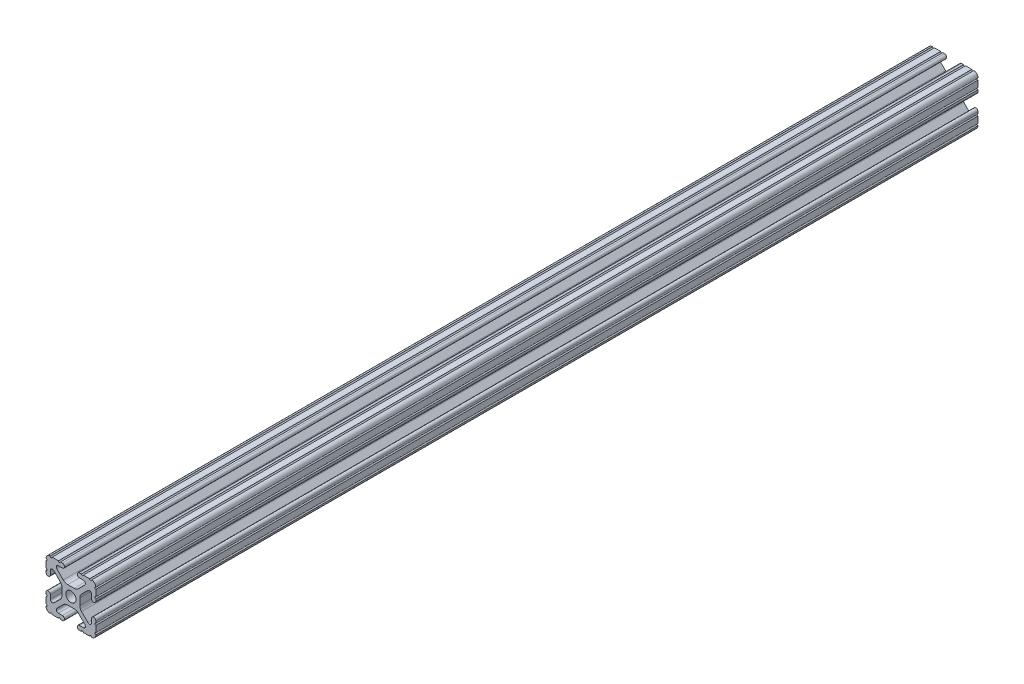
SolidWorks part; units mm, degrees
ref_plane "Front Plane" through (0, 0, 0) normal (0, 0, 1) x (1, 0, 0)
ref_plane "Top Plane" through (0, 0, 0) normal (0, 1, 0) x (1, 0, 0)
ref_plane "Right Plane" through (0, 0, 0) normal (1, 0, 0) x (0, 0, -1)
sketch "Sketch1" plane through (0, 0, 0) normal (0, 0, 1) x (1, 0, 0)
  line L0 (10.5918, 12.7) -> (10.5664, 12.7)
  line L1 (9.5504, 12.7) -> (6.3246, 12.7)
  line L2 (5.3086, 12.7) -> (4.3561, 12.7)
  line L3 (4.3561, 10.4902) -> (6.3701, 10.4902)
  line L4 (7.1192, 8.6817) -> (3.8846, 5.4471)
  line L5 (1.6396, 4.5172) -> (-1.6396, 4.5172)
  line L6 (-3.8846, 5.4471) -> (-7.1192, 8.6817)
  line L7 (-6.3701, 10.4902) -> (-4.3561, 10.4902)
  line L8 (-4.3561, 12.7) -> (-5.3086, 12.7)
  line L9 (-6.3246, 12.7) -> (-9.5504, 12.7)
  line L10 (-10.5664, 12.7) -> (-10.5918, 12.7)
  line L11 (-12.7, 10.5918) -> (-12.7, 10.5664)
  line L12 (-12.7, 9.5504) -> (-12.7, 6.3246)
  line L13 (-12.7, 5.3086) -> (-12.7, 4.3561)
  line L14 (-10.4902, 4.3561) -> (-10.4902, 6.3701)
  line L15 (-8.6817, 7.1192) -> (-5.4471, 3.8846)
  line L16 (-4.5172, 1.6396) -> (-4.5172, -1.6396)
  line L17 (-5.4471, -3.8846) -> (-8.6817, -7.1192)
  line L18 (-10.4902, -6.3701) -> (-10.4902, -4.3561)
  line L19 (-12.7, -4.3561) -> (-12.7, -5.3086)
  line L20 (-12.7, -6.3246) -> (-12.7, -9.5504)
  line L21 (-12.7, -10.5664) -> (-12.7, -10.5918)
  line L22 (-10.5918, -12.7) -> (-10.5664, -12.7)
  line L23 (-9.5504, -12.7) -> (-6.3246, -12.7)
  line L24 (-5.3086, -12.7) -> (-4.3561, -12.7)
  line L25 (-4.3561, -10.4902) -> (-6.3701, -10.4902)
  line L26 (-7.1192, -8.6817) -> (-3.8846, -5.4471)
  line L27 (-1.6396, -4.5172) -> (1.6396, -4.5172)
  line L28 (3.8846, -5.4471) -> (7.1192, -8.6817)
  line L29 (6.3701, -10.4902) -> (4.3561, -10.4902)
  line L30 (4.3561, -12.7) -> (5.3086, -12.7)
  line L31 (6.3246, -12.7) -> (9.5504, -12.7)
  line L32 (10.5664, -12.7) -> (10.5918, -12.7)
  line L33 (12.7, -10.5918) -> (12.7, -10.5664)
  line L34 (12.7, -9.5504) -> (12.7, -6.3246)
  line L35 (12.7, -5.3086) -> (12.7, -4.3561)
  line L36 (10.4902, -4.3561) -> (10.4902, -6.3701)
  line L37 (8.6817, -7.1192) -> (5.4471, -3.8846)
  line L38 (4.5172, -1.6396) -> (4.5172, 1.6396)
  line L39 (5.4471, 3.8846) -> (8.6817, 7.1192)
  line L40 (10.4902, 6.3701) -> (10.4902, 4.3561)
  line L41 (12.7, 4.3561) -> (12.7, 5.3086)
  line L42 (12.7, 6.3246) -> (12.7, 9.5504)
  line L43 (12.7, 10.5664) -> (12.7, 10.5918)
  circle A0 centre (0, 0) radius 2.6035
  arc A1 (12.7, 10.5918) -> (10.5918, 12.7) centre (10.5918, 10.5918) ccw
  arc A2 (9.5504, 12.7) -> (10.5664, 12.7) centre (10.0584, 12.7) ccw
  arc A3 (5.3086, 12.7) -> (6.3246, 12.7) centre (5.8166, 12.7) ccw
  arc A4 (4.3561, 12.7) -> (4.3561, 10.4902) centre (4.3561, 11.5951) ccw
  arc A5 (7.1192, 8.6817) -> (6.3701, 10.4902) centre (6.3701, 9.4308) ccw
  arc A6 (1.6396, 4.5172) -> (3.8846, 5.4471) centre (1.6396, 7.6922) ccw
  arc A7 (-3.8846, 5.4471) -> (-1.6396, 4.5172) centre (-1.6396, 7.6922) ccw
  arc A8 (-6.3701, 10.4902) -> (-7.1192, 8.6817) centre (-6.3701, 9.4308) ccw
  arc A9 (-4.3561, 10.4902) -> (-4.3561, 12.7) centre (-4.3561, 11.5951) ccw
  arc A10 (-6.3246, 12.7) -> (-5.3086, 12.7) centre (-5.8166, 12.7) ccw
  arc A11 (-10.5664, 12.7) -> (-9.5504, 12.7) centre (-10.0584, 12.7) ccw
  arc A12 (-10.5918, 12.7) -> (-12.7, 10.5918) centre (-10.5918, 10.5918) ccw
  arc A13 (-12.7, 9.5504) -> (-12.7, 10.5664) centre (-12.7, 10.0584) ccw
  arc A14 (-12.7, 5.3086) -> (-12.7, 6.3246) centre (-12.7, 5.8166) ccw
  arc A15 (-12.7, 4.3561) -> (-10.4902, 4.3561) centre (-11.5951, 4.3561) ccw
  arc A16 (-8.6817, 7.1192) -> (-10.4902, 6.3701) centre (-9.4308, 6.3701) ccw
  arc A17 (-4.5172, 1.6396) -> (-5.4471, 3.8846) centre (-7.6922, 1.6396) ccw
  arc A18 (-5.4471, -3.8846) -> (-4.5172, -1.6396) centre (-7.6922, -1.6396) ccw
  arc A19 (-10.4902, -6.3701) -> (-8.6817, -7.1192) centre (-9.4308, -6.3701) ccw
  arc A20 (-10.4902, -4.3561) -> (-12.7, -4.3561) centre (-11.5951, -4.3561) ccw
  arc A21 (-12.7, -6.3246) -> (-12.7, -5.3086) centre (-12.7, -5.8166) ccw
  arc A22 (-12.7, -10.5664) -> (-12.7, -9.5504) centre (-12.7, -10.0584) ccw
  arc A23 (-12.7, -10.5918) -> (-10.5918, -12.7) centre (-10.5918, -10.5918) ccw
  arc A24 (-9.5504, -12.7) -> (-10.5664, -12.7) centre (-10.0584, -12.7) ccw
  arc A25 (-5.3086, -12.7) -> (-6.3246, -12.7) centre (-5.8166, -12.7) ccw
  arc A26 (-4.3561, -12.7) -> (-4.3561, -10.4902) centre (-4.3561, -11.5951) ccw
  arc A27 (-7.1192, -8.6817) -> (-6.3701, -10.4902) centre (-6.3701, -9.4308) ccw
  arc A28 (-1.6396, -4.5172) -> (-3.8846, -5.4471) centre (-1.6396, -7.6922) ccw
  arc A29 (3.8846, -5.4471) -> (1.6396, -4.5172) centre (1.6396, -7.6922) ccw
  arc A30 (6.3701, -10.4902) -> (7.1192, -8.6817) centre (6.3701, -9.4308) ccw
  arc A31 (4.3561, -10.4902) -> (4.3561, -12.7) centre (4.3561, -11.5951) ccw
  arc A32 (6.3246, -12.7) -> (5.3086, -12.7) centre (5.8166, -12.7) ccw
  arc A33 (10.5664, -12.7) -> (9.5504, -12.7) centre (10.0584, -12.7) ccw
  arc A34 (10.5918, -12.7) -> (12.7, -10.5918) centre (10.5918, -10.5918) ccw
  arc A35 (12.7, -9.5504) -> (12.7, -10.5664) centre (12.7, -10.0584) ccw
  arc A36 (12.7, -5.3086) -> (12.7, -6.3246) centre (12.7, -5.8166) ccw
  arc A37 (12.7, -4.3561) -> (10.4902, -4.3561) centre (11.5951, -4.3561) ccw
  arc A38 (8.6817, -7.1192) -> (10.4902, -6.3701) centre (9.4308, -6.3701) ccw
  arc A39 (4.5172, -1.6396) -> (5.4471, -3.8846) centre (7.6922, -1.6396) ccw
  arc A40 (5.4471, 3.8846) -> (4.5172, 1.6396) centre (7.6922, 1.6396) ccw
  arc A41 (10.4902, 6.3701) -> (8.6817, 7.1192) centre (9.4308, 6.3701) ccw
  arc A42 (10.4902, 4.3561) -> (12.7, 4.3561) centre (11.5951, 4.3561) ccw
  arc A43 (12.7, 6.3246) -> (12.7, 5.3086) centre (12.7, 5.8166) ccw
  arc A44 (12.7, 10.5664) -> (12.7, 9.5504) centre (12.7, 10.0584) ccw
extrude "Extrude1" add sketch "Sketch1" against normal blind 450
